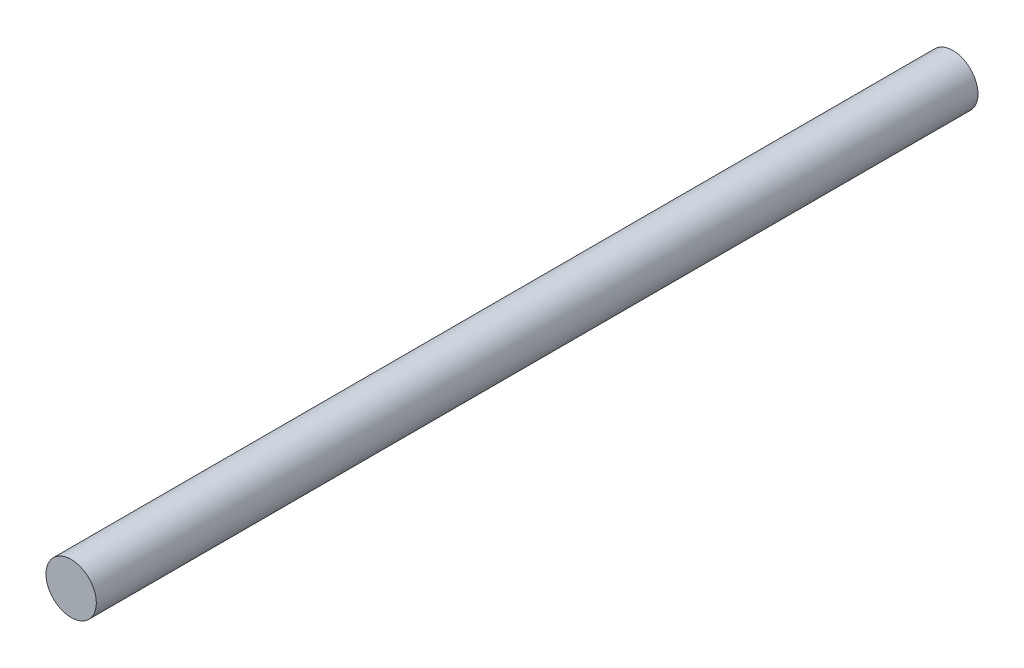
SolidWorks part; units mm, degrees
ref_plane "Front Plane" through (0, 0, 0) normal (0, 0, 1) x (1, 0, 0)
ref_plane "Top Plane" through (0, 0, 0) normal (0, 1, 0) x (1, 0, 0)
ref_plane "Right Plane" through (0, 0, 0) normal (1, 0, 0) x (0, 0, -1)
sketch "Sketch1" plane through (0, 0, 0) normal (0, 0, 1) x (1, 0, 0)
  circle A0 centre (0, 0) radius 1
  dimension "D1" = 2
extrude "Boss-Extrude1" add sketch "Sketch1" along normal mid plane 35
